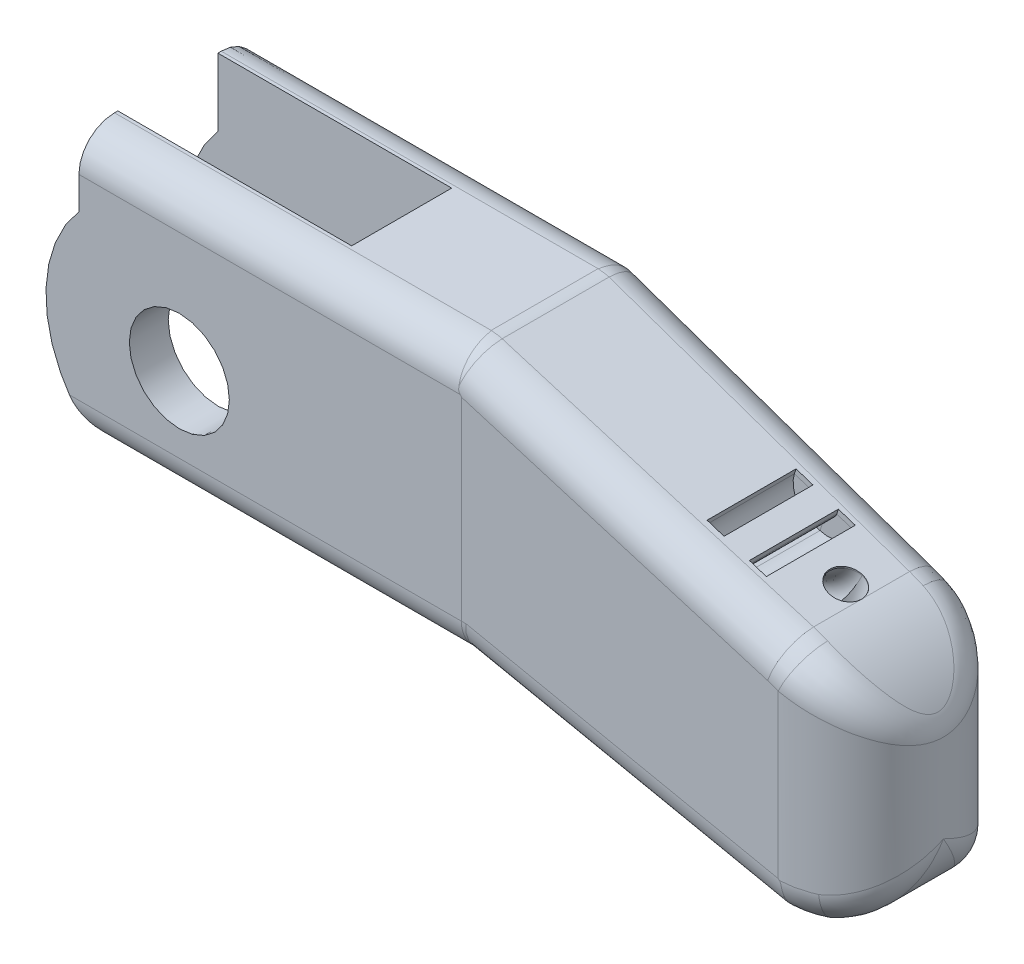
SolidWorks part; units mm, degrees
ref_plane "Front Plane" through (0, 0, 0) normal (0, 0, 1) x (1, 0, 0)
ref_plane "Top Plane" through (0, 0, 0) normal (0, 1, 0) x (1, 0, 0)
ref_plane "Right Plane" through (0, 0, 0) normal (1, 0, 0) x (0, 0, -1)
sketch "Sketch1" plane through (0, 0, 0) normal (0, 1, 0) x (1, 0, 0)
  line L0 (25.4, 12.7) -> (47.625, 12.3031)
  line L1 (0, 0) -> (25.4, 0)
  line L2 (0, 0) -> (0, 12.7)
  line L3 (0, 12.7) -> (25.4, 12.7)
  line L5 (47.625, 0.3969) -> (25.4, 0)
  arc A0 (47.625, 12.3031) -> (47.625, 0.3969) centre (47.5187, 6.35) cw
  point P9 (0, 6.35)
  dimension "D1" = 12.7
  dimension "D2" = 11.9062
  dimension "D3" = 25.4
  dimension "D4" = 22.225
extrude "Boss-Extrude1" add sketch "Sketch1" along normal blind 24.13
sketch "Sketch3" plane through (0, 0, 0) normal (0, 0, 1) x (1, 0, 0)
  line L0 (25.4, 24.13) -> (25.4, 0) construction
  line L1 (0, 0) -> (31.75, 0)
  line L2 (0, 0) -> (0, 5.08)
  line L3 (0, 5.08) -> (25.4, 5.08)
  line L5 (25.4, 5.08) -> (47.625, 0)
  line L6 (47.625, 0) -> (31.75, 0)
  dimension "D1" = 19.05
extrude "Cut-Extrude1" cut sketch "Sketch3" against normal through all
sketch "Sketch4" plane through (0, 0, 0) normal (0, 0, 1) x (1, 0, 0)
  line L0 (25.4, 24.13) -> (47.625, 16.9111)
  line L1 (47.625, 24.13) -> (47.625, 0) construction
  line L2 (53.4728, 0) -> (53.4728, 24.13) construction
  line L3 (53.4728, 11.9883) -> (53.4728, 24.13)
  line L4 (53.4728, 24.13) -> (25.4, 24.13)
  arc A0 (47.625, 16.9111) -> (53.4728, 11.9883) centre (44.4863, 7.248) cw
  dimension "D2" = 10.16
  dimension "D1" = 23.368
extrude "Cut-Extrude2" cut sketch "Sketch4" against normal through all
sketch "Sketch5" plane through (0, 0, 0) normal (0, 0, 1) x (1, 0, 0)
  line L2 (49.1548, 0) -> (53.4728, 0)
  line L3 (53.4728, 0) -> (53.4728, 5.0225)
  arc A0 (53.4728, 5.0225) -> (49.1548, 0) centre (48.3928, 5.0225) cw
  dimension "D1" = 5.08
  dimension "D2" = 4.318
extrude "Cut-Extrude3" cut sketch "Sketch5" against normal through all
sketch "Sketch7" plane through (0, 0, 0) normal (0, 0, 1) x (1, 0, 0)
  line L0 (0, 20.955) -> (0, 5.08)
  line L1 (0, 20.955) -> (0, 24.13)
  line L2 (0, 24.13) -> (25.4, 24.13) construction
  line L3 (0, 24.13) -> (-1.905, 24.13)
  line L4 (-1.905, 24.13) -> (-1.905, 19.2876)
  arc A1 (-1.905, 19.2876) -> (0, 5.08) centre (5.2651, 13.0175) ccw
  dimension "D2" = 19.05
  dimension "D1" = 3.175
  dimension "D3" = 1.905
  dimension "D4" = 4.8424
ref_plane "Plane1" through (0, 0, -6.35) normal (0, 0, 1) x (1, 0, 0)
extrude "Boss-Extrude4" add sketch "Sketch7" against normal up to surface (12.7 mm away)
sketch "Sketch9" plane through (0, 24.13, 0) normal (0, 1, 0) x (1, 0, 0)
  line L0 (-10.4775, 6.35) -> (10.4775, 6.35) construction
  line L5 (-4.2599, 2.7781) -> (14.7901, 2.7781)
  line L6 (-4.2599, 2.7781) -> (-4.2599, 9.9219)
  line L7 (-4.2599, 9.9219) -> (14.7901, 9.9219)
  line L8 (14.7901, 2.7781) -> (14.7901, 9.9219)
  line L11 (-4.2599, 12.7) -> (-4.2599, 0) construction
  point P4 (14.7901, 6.35)
  dimension "D1" = 7.1437
  dimension "D2" = 19.05
extrude "Cut-Extrude5" cut sketch "Sketch9" against normal through all
fillet "Fillet1" radius 2.54 3 edges at (36.5125, 20.5205, -12.5016) (53.4258, 12.0763, -7.0964) (36.5125, 20.5205, -0.1984)
sketch "Sketch10" plane through (0, 0, 0) normal (0, 0, 1) x (1, 0, 0)
  circle A0 centre (5.2651, 13.0175) radius 3.5719
  arc A1 (-1.905, 19.2876) -> (0, 5.08) centre (5.2651, 13.0175) ccw construction
  dimension "D1" = 7.1437
extrude "Cut-Extrude6" cut sketch "Sketch10" against normal through all
sketch "Sketch11" plane through (14.7901, 0, 0) normal (-1, 0, 0) x (0, 0, 1)
  line L0 (-6.35, -10.4775) -> (-6.35, 10.4775) construction
  line L1 (-2.7781, 24.13) -> (-9.9219, 24.13) construction
  circle A0 centre (-6.35, 22.225) radius 1.1906
  dimension "D1" = 2.3813
  dimension ".075" = 1.905
sketch "Sketch12" plane through (0, 0, -6.35) normal (0, 0, 1) x (1, 0, 0)
  line L0 (25.4, 18.2486) -> (14.7901, 21.0344)
  line L1 (47.625, 16.9111) -> (49.9198, 21.5724)
  line L2 (25.4, 21.4741) -> (25.4, 5.08) construction
  line L3 (25.4, 18.2486) -> (39.3778, 13.7084)
  line L5 (46.8857, 14.4953) -> (25.4, 21.4741) construction
  arc A0 (39.3778, 13.7084) -> (47.625, 16.9111) centre (41.5392, 20.3627) ccw
  dimension "D2" = 6.9965
  dimension "D1" = 3.0677
  dimension "D3" = 4.6613
  dimension "D4" = 2.2948
sweep "Cut-Sweep1" cut profiles "Sketch11" path "Sketch12"
sketch "Sketch13" plane through (9.5137, 29.29, 0) normal (0.3089, 0.9511, 0) x (0.9511, -0.3089, 0)
  line L0 (16.7033, 10.1736) -> (16.7033, 2.5264) construction
  line L1 (34.9913, 9.525) -> (36.2613, 9.525)
  line L2 (34.9913, 9.525) -> (34.9913, 3.175)
  line L3 (34.9913, 3.175) -> (36.2613, 3.175)
  line L4 (36.2613, 9.525) -> (36.2613, 3.175)
  line L6 (46.1107, 6.35) -> (37.9024, 6.35) construction
  line L7 (40.0713, 6.35) -> (40.0713, 2.9233) construction
  point P6 (36.2613, 6.35)
  point P12 (16.7033, 6.35)
  point P14 (40.0713, 4.6366)
  dimension "D1" = 6.35
  dimension "D2" = 1.27
  dimension "D3" = 3.81
sketch "Sketch14" plane through (0, 0, -6.35) normal (0, 0, 1) x (1, 0, 0)
  line L1 (42.7935, 18.4804) -> (42.6758, 18.118)
  line L2 (53.369, 15.0454) -> (45.5622, 17.5811) construction
  line L3 (41.8757, 17.7103) -> (41.2717, 17.9064)
  line L4 (40.864, 18.7065) -> (40.9817, 19.0689)
  arc A0 (42.6758, 18.118) -> (41.8757, 17.7103) centre (42.0718, 18.3142) cw
  arc A1 (41.2717, 17.9064) -> (40.864, 18.7065) centre (41.4679, 18.5104) cw
  point P9 (42.4796, 17.5141)
  point P12 (40.6678, 18.1026)
  dimension "D3" = 0.635
  dimension "D1" = 1.905
  dimension "D2" = 1.016
sweep "Cut-Sweep2" cut profiles "Sketch13" path "Sketch14"
sketch "Sketch15" plane through (14.7901, 0, 0) normal (-1, 0, 0) x (0, 0, 1)
  line L0 (-6.35, -10.4775) -> (-6.35, 10.4775) construction
  line L1 (-2.7781, 5.08) -> (-9.9219, 5.08) construction
  circle A0 centre (-6.35, 6.985) radius 1.1906
  dimension "D1" = 2.3812
  dimension "D2" = 1.905
sketch "Sketch16" plane through (0, 0, -6.35) normal (0, 0, 1) x (1, 0, 0)
  line L0 (14.7901, 8.1756) -> (19.8701, 11.5938)
  line L3 (19.8701, 11.5938) -> (25.4, 11.5938)
  line L4 (25.4, 21.4741) -> (25.4, 5.08) construction
  line L5 (25.4, 11.5938) -> (37.7807, 8.7639)
  line L6 (25.4, 5.08) -> (47.625, 0) construction
  line L7 (25.4, 5.08) -> (0, 5.08) construction
  arc A0 (37.7807, 8.7639) -> (42.5561, 1.1586) centre (36.3658, 2.5735) cw
  dimension "D1" = 5.08
  dimension "D2" = 5.0689
  dimension "D3" = 6.35
sweep "Cut-Sweep5" cut profiles "Sketch15" path "Sketch16"
sketch "Sketch17" plane through (2.3646, 10.3452, 0) normal (-0.2228, -0.9749, 0) x (0.9749, -0.2228, 0)
  line L0 (30.7439, -6.35) -> (46.4276, -6.35) construction
  line L1 (36.7756, -3.175) -> (38.0456, -3.175)
  line L2 (36.7756, -3.175) -> (36.7756, -9.525)
  line L3 (36.7756, -9.525) -> (38.0456, -9.525)
  line L4 (38.0456, -3.175) -> (38.0456, -9.525)
  line L5 (10.4775, -6.35) -> (-10.4775, -6.35) construction
  line L6 (46.4276, -12.3031) -> (46.4276, -0.3969) construction
  point P10 (36.7756, -6.35)
  dimension "D1" = 6.35
  dimension "D2" = 1.27
  dimension "D3" = 8.382
sketch "Sketch19" plane through (0, 0, -6.35) normal (0, 0, 1) x (1, 0, 0)
  line L0 (36.3586, 2.5752) -> (36.4435, 2.9466)
  line L1 (32.3356, 3.4947) -> (47.625, 0) construction
  line L2 (37.204, 3.4241) -> (37.823, 3.2827)
  line L3 (38.3006, 2.5221) -> (38.2157, 2.1507)
  arc A0 (37.823, 3.2827) -> (38.3006, 2.5221) centre (37.6815, 2.6636) cw
  arc A1 (36.4435, 2.9466) -> (37.204, 3.4241) centre (37.0625, 2.8051) cw
  point P9 (38.4421, 3.1412)
  point P12 (36.585, 3.5656)
  dimension "D3" = 0.635
  dimension "D1" = 1.016
  dimension "D2" = 1.905
sweep "Cut-Sweep6" cut profiles "Sketch17" path "Sketch19"
sketch "Sketch21" plane through (0, 5.08, 0) normal (0, -1, 0) x (1, 0, 0)
  line L1 (18.9176, -2.3812) -> (20.5051, -2.3812)
  line L2 (18.9176, -2.3812) -> (18.9176, -10.3187)
  line L3 (18.9176, -10.3187) -> (20.5051, -10.3187)
  line L4 (20.5051, -2.3812) -> (20.5051, -10.3187)
  line L5 (10.4775, -6.35) -> (-10.4775, -6.35) construction
  line L6 (14.7901, -2.7781) -> (14.7901, -9.9219) construction
  point P4 (20.5051, -6.35)
  point P9 (14.7901, -6.35)
  dimension "D1" = 7.9375
  dimension "D2" = 1.5875
  dimension "D3" = 4.1275
sketch "Sketch22" plane through (0, 0, -6.35) normal (0, 0, 1) x (1, 0, 0)
  line L0 (20.5051, 5.08) -> (23.3449, 7.62)
  line L1 (29.2712, 6.7351) -> (33.0436, 3.3329)
  line L2 (23.3449, 7.62) -> (25.4, 7.62)
  line L4 (25.4, 7.62) -> (29.2712, 6.7351)
  line L5 (25.4, 5.08) -> (47.625, 0) construction
  line L6 (25.4, 5.08) -> (0, 5.08) construction
  line L8 (25.4, 21.4741) -> (25.4, 5.08) construction
  point P2 (24.3725, 7.62)
  dimension "D4" = 3.81
  dimension "D1" = 2.54
  dimension "D2" = 2.1304
  dimension "D3" = 5.08
sweep "Cut-Sweep7" cut profiles "Sketch21" path "Sketch22"
fillet "Fillet5" radius 2.54 5 edges at (25.4, 24.13, -6.35) (23.7787, 24.13, -11.7145) (23.7787, 24.13, -0.9855) (8.8246, 24.13, 0) (8.8246, 24.13, -12.7)
fillet "Fillet6" radius 2.54 6 edges at (36.5125, 2.54, -12.5016) (48.3973, 0, -0.4611) (48.3973, 0, -12.2389) (52.009, 1.4547, -10.26) (52.009, 1.4547, -2.44) (36.5125, 2.54, -0.1984)
fillet "Fillet7" radius 2.54 4 edges at (31.1222, 5.08, -12.5978) (12.7, 5.08, -12.7) (31.1222, 5.08, -0.1022) (12.7, 5.08, 0)
sketch "Sketch23" plane through (9.5137, 29.29, 0) normal (0.3089, 0.9511, 0) x (0.9511, -0.3089, 0)
  line L0 (-10.4775, 6.35) -> (10.4775, 6.35) construction
  line L1 (40.0713, 9.7767) -> (40.0713, 6.35) construction
  circle A0 centre (38.8807, 6.35) radius 1.1906
  dimension "D1" = 2.3812
sketch "Sketch24" plane through (0, 0, -6.35) normal (0, 0, 1) x (1, 0, 0)
  line L0 (47.625, 16.9111) -> (42.556, 1.1588)
  spline S0 degree 3 poles (42.556, 1.1586) (42.5801, 1.265) (42.6023, 1.3731) (42.7876, 2.4368) (42.7398, 3.5203) (42.0531, 5.6032) (41.4103, 6.5866) (39.7515, 8.0589) (38.7515, 8.542) (37.7807, 8.7639) knots 0.505811 0.505811 0.505811 0.505811 0.520139 0.520139 0.643686 0.643686 0.767234 0.767234 0.890781 0.890781 0.890781 0.890781 weights 0.5 0.5 0.5 0.5 0.5 0.5 0.5 0.5 0.5 0.5 construction
  dimension "D1" = 15.7523
sweep "Cut-Sweep8" cut profiles "Sketch23" path "Sketch24"
